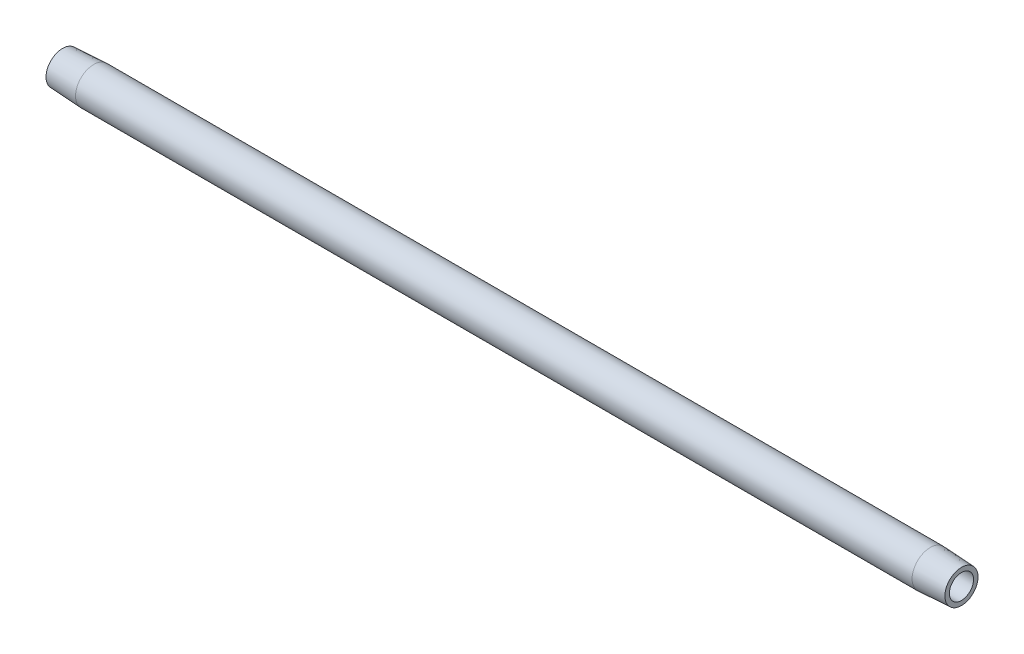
SolidWorks part; units mm, degrees
ref_plane "Front Plane" through (0, 0, 0) normal (0, 0, 1) x (1, 0, 0)
ref_plane "Top Plane" through (0, 0, 0) normal (0, 1, 0) x (1, 0, 0)
ref_plane "Right Plane" through (0, 0, 0) normal (1, 0, 0) x (0, 0, -1)
sketch "Sketch2" plane through (0, 0, 0) normal (0, 0, 1) x (1, 0, 0)
  line L0 (0.4761, 0) -> (50000.4761, 0) construction
  line L1 (0, -11.3625) -> (0, 49988.6375) construction
  line L7 (8.81, 5.1435) -> (0, 4.6818)
  line L8 (245.19, 5.1435) -> (8.81, 5.1435)
  line L9 (254, 4.6818) -> (245.19, 5.1435)
  line L10 (254, 3.4163) -> (254, 4.6818)
  line L11 (254, 3.4163) -> (0, 3.4163)
  line L12 (0, 4.6818) -> (0, 3.4163)
  dimension "D1" = 6.8326
  dimension "D2" = 10.287
  dimension "D3" = 3
  dimension "D4" = 3
  dimension "D5" = 8.81
  dimension "D6" = 8.81
  dimension "D7" = 254
revolve "Revolve1" add sketch "Sketch2" angle 360 about L0
